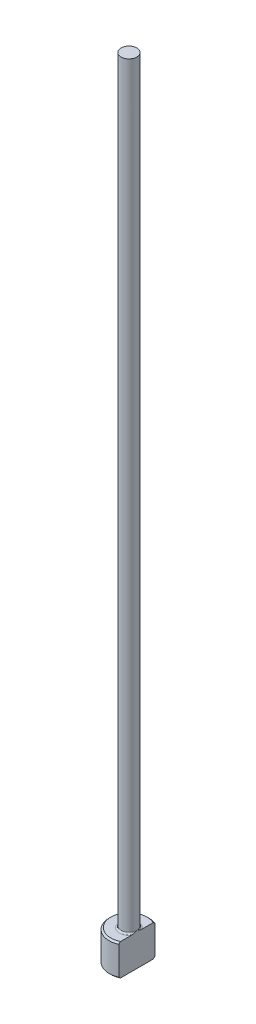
SolidWorks part; units mm, degrees
ref_plane "Front Plane" through (0, 0, 0) normal (0, 0, 1) x (1, 0, 0)
ref_plane "Top Plane" through (0, 0, 0) normal (0, 1, 0) x (1, 0, 0)
ref_plane "Right Plane" through (0, 0, 0) normal (1, 0, 0) x (0, 0, -1)
sketch "Sketch1" plane through (0, 0, 0) normal (0, 0, 1) x (1, 0, 0)
  line L0 (0, 259.9588) -> (0, -15.1925) construction
  line L1 (0, 0) -> (-2.5, 0)
  line L2 (-2.5, 0) -> (-2.5, 4)
  line L3 (-2.5, 4) -> (-1, 4)
  line L4 (-1, 4) -> (-1, 100)
  line L5 (-1, 100) -> (0, 100)
  line L6 (0, 100) -> (0, 0)
  dimension "L" = 100
  dimension "H" = 5
  dimension "T" = 4
  dimension "D" = 2
revolve "Revolve1" add sketch "Sketch1" angle 360 about L0
chamfer "Chamfer1" distance 0.2 angle 45 2 edges at (0, 4, 2.5) (0, 0, 2.5)
fillet "Fillet1" radius 0.2 1 edges at (0, 4, 1)
sketch "Sketch2" plane through (0, 0, 0) normal (0, 1, 0) x (1, 0, 0)
  line L0 (1, -2.2913) -> (1, 2.2913)
  circle A0 centre (0, 0) radius 2.5 construction
  arc A1 (1, -2.2913) -> (1, 2.2913) centre (0, 0) ccw
  circle A2 centre (0, 0) radius 1 construction
extrude "KEYED HEAD" cut sketch "Sketch2" along normal through all
